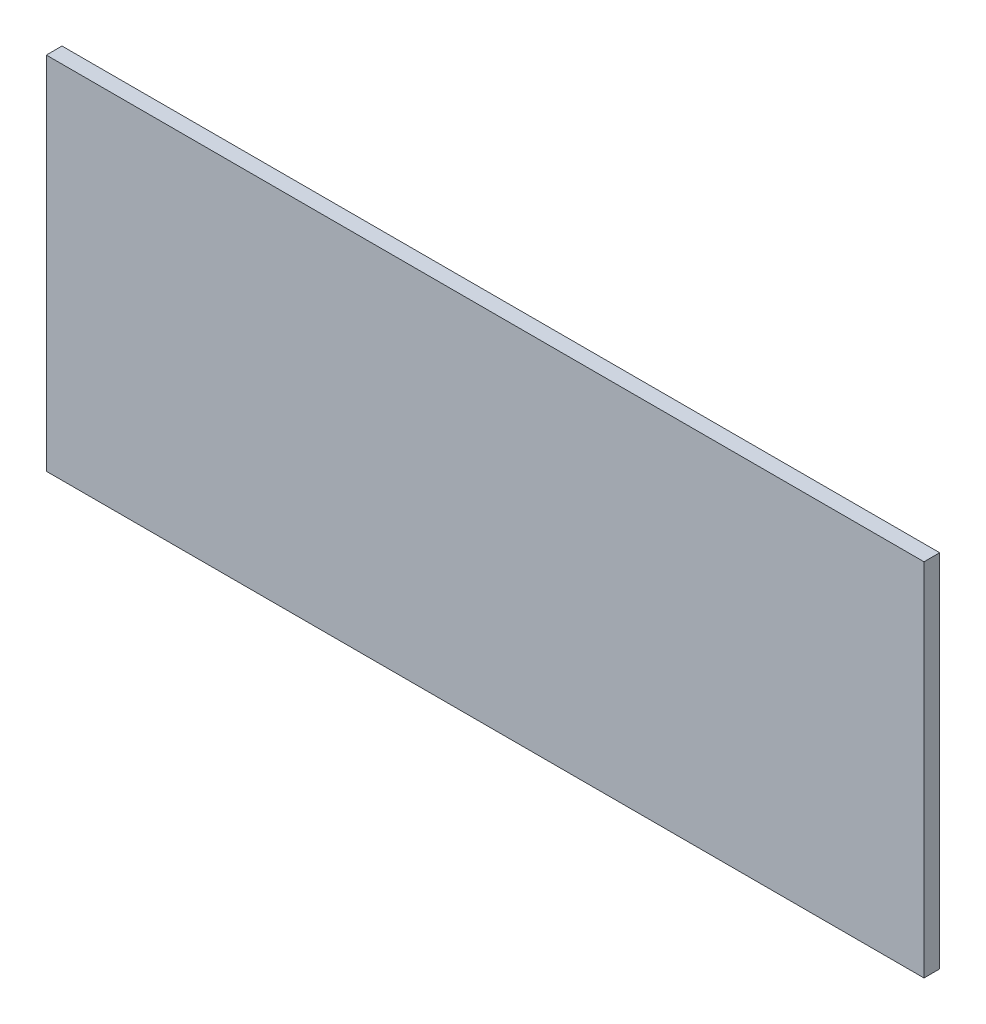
SolidWorks part; units mm, degrees
ref_plane "Front Plane" through (0, 0, 0) normal (0, 0, 1) x (1, 0, 0)
ref_plane "Top Plane" through (0, 0, 0) normal (0, 1, 0) x (1, 0, 0)
ref_plane "Right Plane" through (0, 0, 0) normal (1, 0, 0) x (0, 0, -1)
sketch "Sketch1" plane through (0, 0, 0) normal (0, 0, 1) x (1, 0, 0)
  line L1 (0, 0) -> (1066.8, 0)
  line L2 (0, 0) -> (0, 438.15)
  line L3 (0, 438.15) -> (1066.8, 438.15)
  line L4 (1066.8, 0) -> (1066.8, 438.15)
  dimension "D1" = 438.15
  dimension "D2" = 1066.8
extrude "Extrude1" add sketch "Sketch1" along normal blind 19.05
